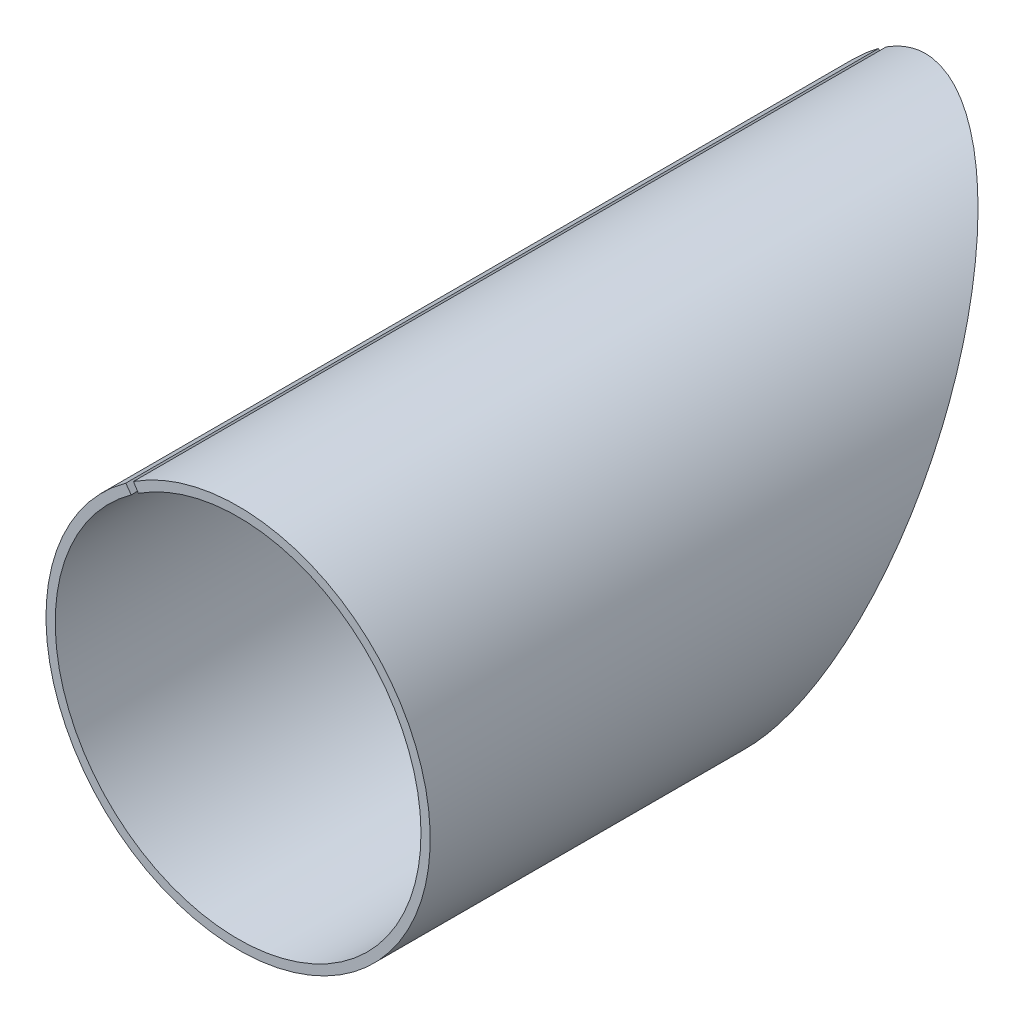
SolidWorks part; units mm, degrees
ref_plane "前视基准面" through (0, 0, 0) normal (0, 0, 1) x (1, 0, 0)
ref_plane "上视基准面" through (0, 0, 0) normal (0, 1, 0) x (1, 0, 0)
ref_plane "右视基准面" through (0, 0, 0) normal (1, 0, 0) x (0, 0, -1)
imported_body "基体零件-双扭向90°和任意角度蛇形弯管-1"
sheet metal parameters "钣金1" parameters "D1"=0.7366, "厚度"=1
bend "圆角折弯1" bend radius 19.786 bend angle 357.243 parameters "D5"=1
flatten bends "展开-折弯1"
sketch "尖角-草图1" plane through (-45.5822, 67.4837, 19.9371) normal (-0.5448, 0.8386, 0) x (-0.8386, -0.5448, 0)
  line L0 (-61.6837, -40.7171) -> (-61.6837, 40.7171) construction
  dimension "D1" = 0
process bends "加工-折弯1" parameters "D1"=0
sketch "平面-草图1" plane through (-45.5822, 67.4837, 19.9371) normal (-0.5448, 0.8386, 0) x (-0.8386, -0.5448, 0)
